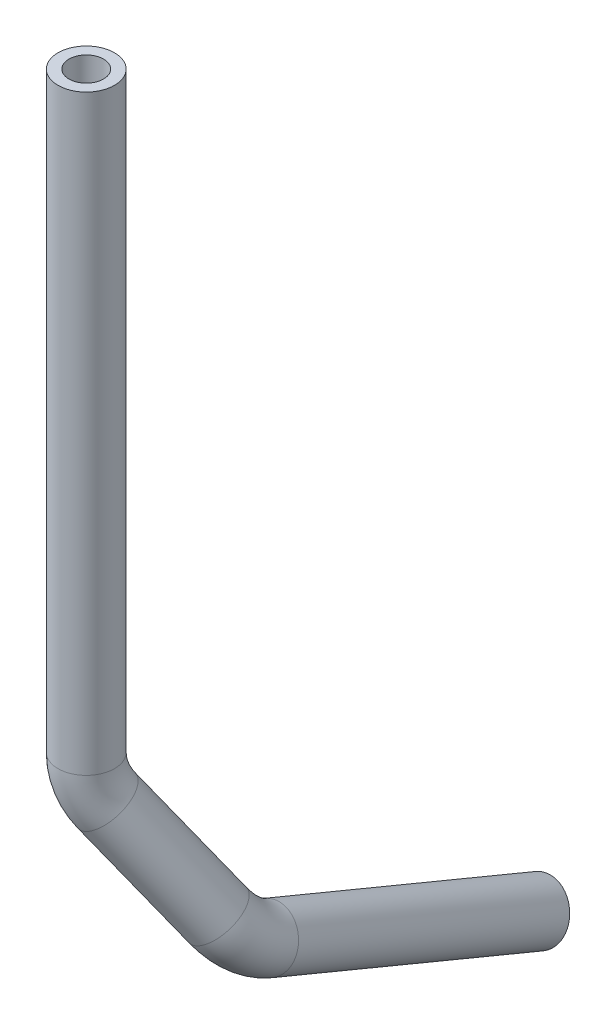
SolidWorks part; units mm, degrees
ref_plane "Front" through (0, 0, 0) normal (0, 0, 1) x (1, 0, 0)
ref_plane "Top" through (0, 0, 0) normal (0, 1, 0) x (1, 0, 0)
ref_plane "Right" through (0, 0, 0) normal (1, 0, 0) x (0, 0, -1)
sketch3d "3DSketch1"
  line L0 (0, 0, 0) -> (0, -166.3979, 0)
  line L2 (21.844, -215.3628, -29.3635) -> (21.844, -246.9407, -105.5994)
  line L3 (21.844, -203.2, 0) -> (21.844, -154.7571, 0) construction
  line L4 (18.4061, -206.1542, -18.6021) -> (2.883, -178.2034, -2.9137)
  arc A0 (2.883, -178.2034, -2.9137) -> (0, -166.3979, 0) centre (13.3989, -166.3979, -13.5415) ccw
  arc A1 (18.4061, -206.1542, -18.6021) -> (21.844, -215.3628, -29.3635) centre (10.0976, -201.5069, -35.1028) ccw
  point P9 (0, -173.0122, 0)
  point P10 (-0.1426, -166.3979, -26.9404)
  point P13 (21.844, -212.3444, -22.0765)
  point P14 (25.0951, -190.6546, -39.5979)
  dimension "D2" = 19.05
  dimension "D1" = 90.4045
  dimension "D4" = 112.5
sketch "Sketch1" plane through (0, 0, 0) normal (0, 1, 0) x (1, 0, 0)
  circle A0 centre (0, 0) radius 4.8641
  circle A1 centre (0, 0) radius 7.9375
  dimension "D1" = 15.875
  dimension "D2" = 9.7282
sweep "Sweep1" add profiles "Sketch1" path "3DSketch1"
